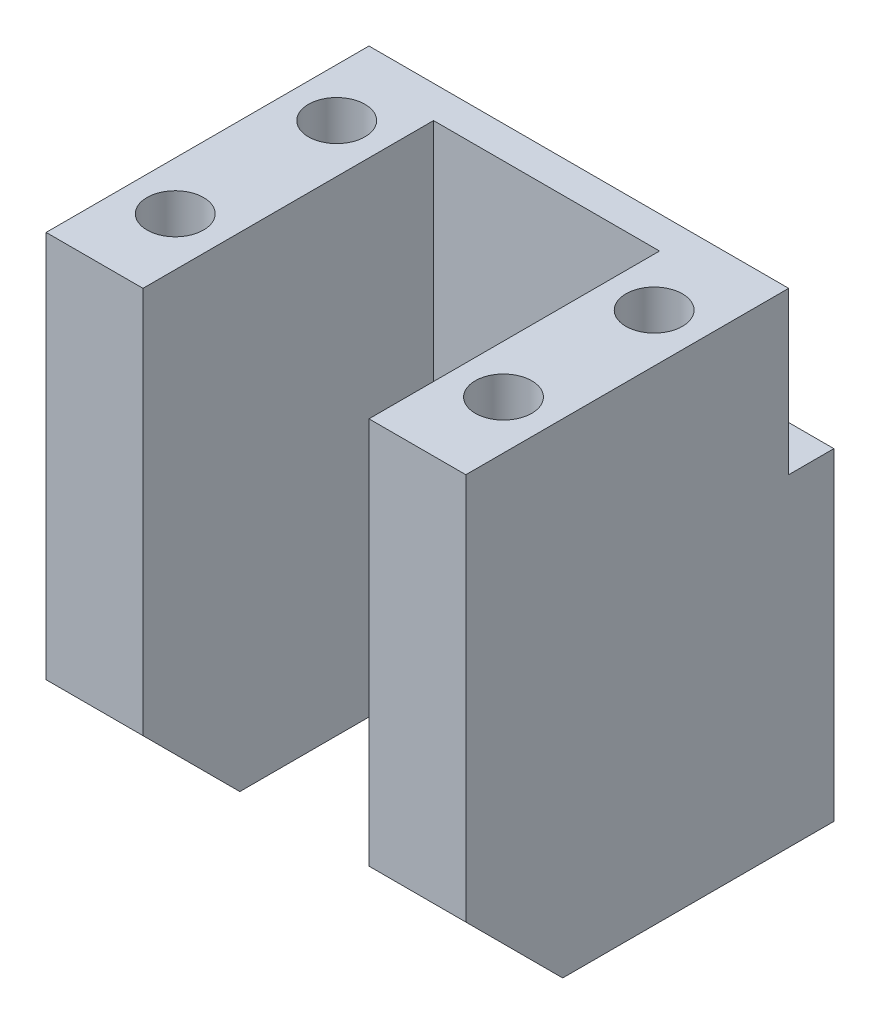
SolidWorks part; units mm, degrees
ref_plane "Plan de face" through (0, 0, 0) normal (0, 0, 1) x (1, 0, 0)
ref_plane "Plan de dessus" through (0, 0, 0) normal (0, 1, 0) x (1, 0, 0)
ref_plane "Plan de droite" through (0, 0, 0) normal (1, 0, 0) x (0, 0, -1)
sketch "Esquisse1" plane through (0, 0, 0) normal (0, 1, 0) x (1, 0, 0)
  line L0 (0, 10) -> (7, 10) construction
  line L1 (0, 0) -> (26, 0)
  line L2 (0, 0) -> (0, 20)
  line L3 (0, 20) -> (26, 20)
  line L4 (26, 0) -> (26, 20)
  line L5 (13, 0) -> (13, 20) construction
  line L6 (9.75, 10) -> (9.75, 16)
  line L7 (9.75, 7.188) -> (16.25, 7.188)
  line L8 (9.75, 7.188) -> (9.75, 3.688)
  line L9 (9.75, 3.688) -> (16.25, 3.688)
  line L10 (16.25, 7.188) -> (16.25, 3.688)
  line L11 (9.75, 10) -> (7, 10)
  line L12 (7, 10) -> (7, 16)
  line L13 (7, 16) -> (9.75, 16)
  line L14 (19.005, 16) -> (19.005, 10)
  line L15 (11.63, 10) -> (11.63, 16)
  line L16 (14.38, 10) -> (14.38, 16)
  line L17 (16.255, 10) -> (16.255, 16)
  line L18 (11.63, 16) -> (14.38, 16)
  line L19 (11.63, 10) -> (14.38, 10) construction
  line L20 (11.63, 10) -> (14.38, 10)
  line L21 (16.255, 10) -> (19.005, 10)
  line L23 (16.255, 16) -> (19.005, 16)
  line L24 (6, 2) -> (6, 18)
  line L25 (20, 2) -> (20, 18)
  line L26 (6, 2) -> (20, 2)
  line L27 (6, 18) -> (20, 18)
  circle A0 centre (3, 15) radius 1.75
  circle A1 centre (23, 14.6656) radius 1.75
  circle A2 centre (23, 5.3344) radius 1.75
  circle A3 centre (3, 5) radius 1.75
  point P17 (13, 13)
  dimension "D3" = 3.5
  dimension "D9" = 2
  dimension "D11" = 6.5
  dimension "D13" = 3.5
  dimension "D1" = 20
  dimension "D4" = 20
  dimension "D5" = 20
  dimension "D6" = 10
  dimension "D7" = 3
  dimension "D8" = 5
  dimension "D10" = 3
  dimension "D12" = 3.688
  dimension "D14" = 6.5
  dimension "D15" = 2.75
  dimension "D16" = 2
  dimension "D17" = 14
  dimension "D18" = 16
  dimension "D19" = 2.75
  dimension "D20" = 2.75
  dimension "D21" = 1.875
  dimension "D22" = 26
  dimension "D23" = 3
  dimension "D24" = 1.88
extrude "Boss.-Extru.1" add sketch "Esquisse1" along normal blind 30 contours L1 L4 L3 L2 A1 A0 L24 L27 L25 L26 A2 A3
chamfer "Chanfrein1" distance 6 angle 45 1 edges at (13, 0, 0)
sketch "Esquisse3" plane through (0, 0, -2) normal (0, 0, -1) x (-1, 0, 0)
  line L0 (-6, 30) -> (-20, 30) construction
  line L1 (-6, 0) -> (-20, 0)
  line L2 (-6, 0) -> (-6, 30)
  line L3 (-6, 30) -> (-20, 30)
  line L4 (-20, 0) -> (-20, 30)
  dimension "D1" = 0
  dimension "D2" = 14
extrude "Enlèv. mat.-Extru.1" cut sketch "Esquisse3" against normal through all
sketch "Esquisse4" plane through (0, 0, -20) normal (0, 0, -1) x (-1, 0, 0)
  line L0 (0, 30) -> (0, 0) construction
  line L1 (-26, 0) -> (0, 0)
  line L2 (-26, 0) -> (-26, 20)
  line L3 (-26, 20) -> (0, 20)
  line L4 (0, 0) -> (0, 20)
  line L5 (0, 30) -> (-26, 30) construction
  dimension "D1" = 10
  dimension "D2" = 20
  dimension "D3" = 26
extrude "Boss.-Extru.2" add sketch "Esquisse4" along normal blind 2.8
sketch "Esquisse5" plane through (0, 20, 0) normal (0, 1, 0) x (1, 0, 0)
  line L0 (13, 20) -> (13, 22.8) construction
  line L1 (0, 20) -> (26, 20) construction
  line L2 (0, 22.8) -> (26, 22.8) construction
  line L3 (26, 20) -> (22.2, 20)
  line L4 (22.2, 20) -> (19.4, 22.8)
  line L5 (19.4, 22.8) -> (6.6, 22.8)
  line L6 (22.2, 20) -> (3.8, 20)
  line L7 (3.8, 20) -> (6.6, 22.8)
  line L8 (0, 20) -> (3.8, 20)
  dimension "D1" = 3.8
  dimension "D2" = 3.8
  dimension "D3" = 45
extrude "Enlèv. mat.-Extru.2" cut sketch "Esquisse5" against normal through all contours L0 L6 L4 M3 | L0 L5 L7 M1
fillet "Congé1" radius 0.5 2 edges at (6.6, 10, -22.8) (19.4, 10, -22.8)
